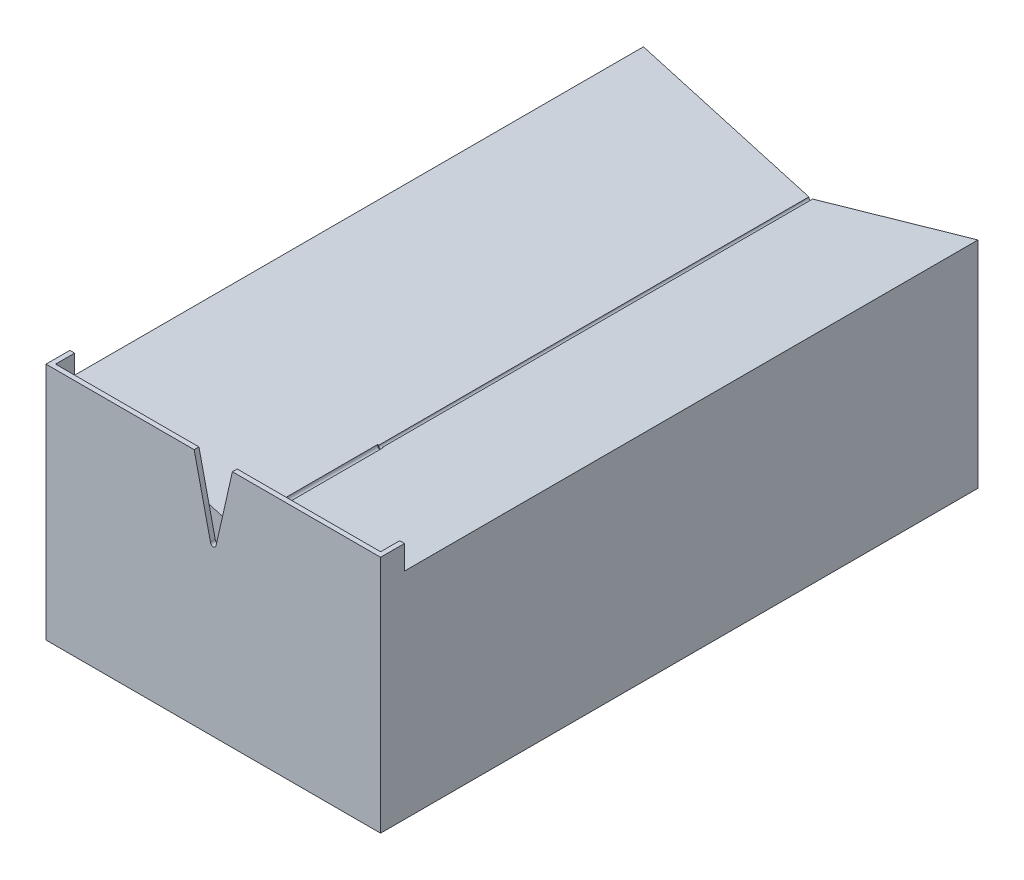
SolidWorks part; units mm, degrees
ref_plane "Plano frontal" through (0, 0, 0) normal (0, 0, 1) x (1, 0, 0)
ref_plane "Plano superior" through (0, 0, 0) normal (0, 1, 0) x (1, 0, 0)
ref_plane "Plano direito" through (0, 0, 0) normal (1, 0, 0) x (0, 0, -1)
sketch "Esboço1" plane through (0, 0, 0) normal (0, 0, 1) x (1, 0, 0)
  line L1 (35, -22.5) -> (-35, -22.5)
  line L2 (35, -22.5) -> (35, 22.5)
  line L4 (-35, -22.5) -> (-35, 22.5)
  line L5 (35, -22.5) -> (-35, 22.5) construction
  line L6 (35, 22.5) -> (-35, -22.5) construction
  line L7 (-35, 22.5) -> (-0.3846, 12.6099)
  line L8 (0.3846, 12.6099) -> (35, 22.5)
  arc A0 (-0.3846, 12.6099) -> (0.3846, 12.6099) centre (0, 12.5) ccw
  point P0 (0, 0)
  dimension "D3" = 0.8
  dimension "D1" = 45
  dimension "D2" = 70
extrude "Ressalto-extrusão2" add sketch "Esboço1" along normal blind 120
sketch "Esboço2" plane through (0, 0, 120) normal (0, 0, 1) x (1, 0, 0)
  line L0 (-35, -22.5) -> (35, -22.5)
  line L1 (-35, -22.5) -> (-35, 27.5)
  line L2 (35, -22.5) -> (35, 27.5)
  line L3 (-35, 27.5) -> (35, 27.5)
  dimension "D1" = 50
extrude "Ressalto-extrusão3" add sketch "Esboço2" along normal blind 5
sketch "Esboço3" plane through (0, 27.5, 0) normal (0, 1, 0) x (1, 0, 0)
  line L5 (35, -124) -> (-35, -124)
  line L6 (34, -124) -> (-34, -124)
  line L8 (-34, -125) -> (-34, -120)
  line L9 (-34, -124) -> (-34, -120)
  line L10 (-34, -120) -> (34, -120)
  line L11 (34, -125) -> (34, -120)
  line L12 (34, -124) -> (34, -120)
  dimension "D1" = 1
  dimension "D2" = 1
  dimension "D3" = 1
extrude "Corte-extrusão1" cut sketch "Esboço3" against normal blind 48
sketch "Esboço5" plane through (0, 0, 0) normal (0, 0, -1) x (-1, 0, 0)
  circle A0 centre (0, 12.5) radius 0.4
extrude "Corte-extrusão4" cut sketch "Esboço5" against normal blind 127
sketch "Esboço6" plane through (0, 0, 125) normal (0, 0, 1) x (1, 0, 0)
  circle A0 centre (0, 12.5) radius 0.6
  dimension "D1" = 1.2
extrude "Corte-extrusão6" cut sketch "Esboço6" against normal blind 35
sketch "Esboço7" plane through (0, 0, 125) normal (0, 0, 1) x (1, 0, 0)
  line L0 (0.6, 12.5) -> (4, 27.5)
  line L1 (35, 27.5) -> (-35, 27.5) construction
  line L2 (4, 27.5) -> (0, 27.5)
  line L3 (0, 27.5) -> (-4, 27.5)
  line L4 (-0.6, 12.5) -> (-4, 27.5)
  line L5 (-0.6, 12.5) -> (0.6, 12.5)
  circle A0 centre (0, 12.5) radius 0.6 construction
extrude "Corte-extrusão7" cut sketch "Esboço7" against normal blind 4
